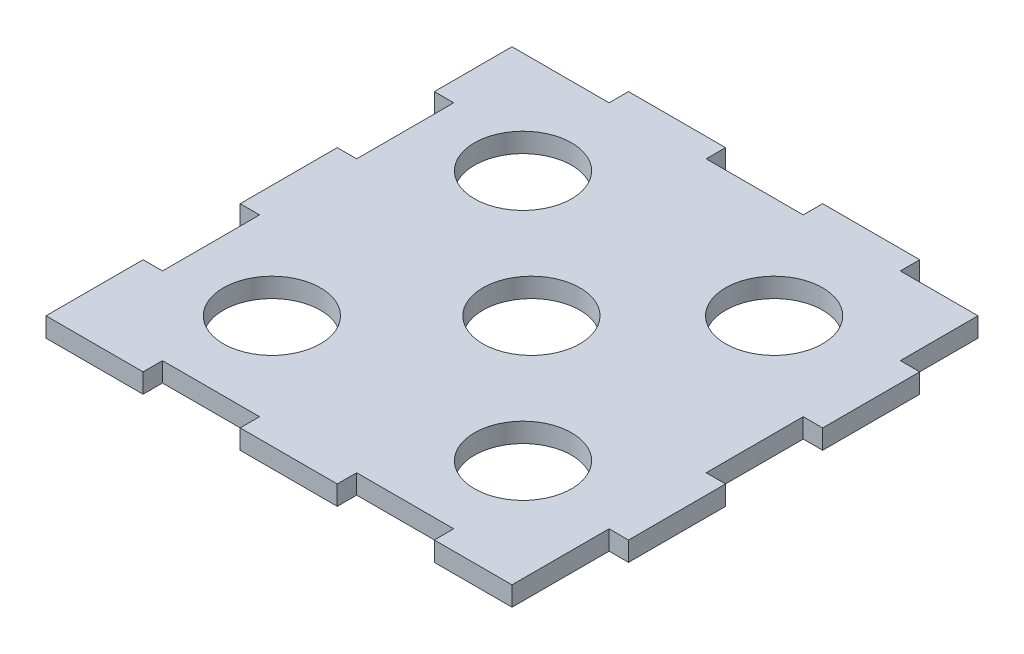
SolidWorks part; units mm, degrees
ref_plane "Front Plane" through (0, 0, 0) normal (0, 0, 1) x (1, 0, 0)
ref_plane "Top Plane" through (0, 0, 0) normal (0, 1, 0) x (1, 0, 0)
ref_plane "Right Plane" through (0, 0, 0) normal (1, 0, 0) x (0, 0, -1)
sketch "Sketch2" plane through (0, 0, 0) normal (0, 1, 0) x (1, 0, 0)
  line L1 (-50, 46) -> (-30, 46)
  line L2 (-50, 46) -> (-50, 30)
  line L3 (-50, -50) -> (-30, -50)
  line L4 (46, 46) -> (46, 30)
  line L8 (-30, 46) -> (-30, 50)
  line L9 (-30, 50) -> (-10, 50)
  line L11 (46, 30) -> (50, 30)
  line L14 (-10, 50) -> (-10, 46)
  line L15 (-10, 46) -> (10, 46)
  line L16 (10, 46) -> (10, 50)
  line L17 (10, 50) -> (30, 50)
  line L18 (30, 50) -> (30, 46)
  line L19 (30, 46) -> (46, 46)
  line L20 (-30, -50) -> (-30, -46)
  line L21 (-30, -46) -> (-10, -46)
  line L22 (-10, -46) -> (-10, -50)
  line L23 (-10, -50) -> (10, -50)
  line L24 (10, -50) -> (10, -46)
  line L25 (10, -46) -> (30, -46)
  line L26 (30, -46) -> (30, -50)
  line L27 (30, -50) -> (46, -50)
  line L29 (50, 30) -> (50, 10)
  line L30 (50, 10) -> (46, 10)
  line L31 (46, 10) -> (46, -10)
  line L32 (46, -10) -> (50, -10)
  line L33 (50, -10) -> (50, -30)
  line L34 (50, -30) -> (46, -30)
  line L35 (46, -30) -> (46, -50)
  line L36 (-50, 30) -> (-46, 30)
  line L37 (-46, 30) -> (-46, 10)
  line L38 (-46, 10) -> (-50, 10)
  line L39 (-50, 10) -> (-50, -10)
  line L40 (-50, -10) -> (-46, -10)
  line L41 (-46, -10) -> (-46, -30)
  line L42 (-46, -30) -> (-50, -30)
  line L43 (-50, -30) -> (-50, -50)
  circle A0 centre (0, 0) radius 10
  circle A1 centre (25, 25) radius 10
  circle A2 centre (25, -26.7321) radius 10
  circle A3 centre (-26.7321, -26.7321) radius 10
  circle A4 centre (-26.7321, 25) radius 10
  point P0 (0, 0)
extrude "Boss-Extrude1" add sketch "Sketch2" along normal blind 4
equation "\"Slit thick\"= 4"
equation "\"Slit wide\"= 20"
equation "\"Piece Thick\"= 4"
equation "\"Slit distance\"= 20"
equation "\"D3@Sketch2\"=\"Slit distance\""
equation "\"D4@Sketch2\"=\"Slit distance\""
equation "\"D6@Sketch2\"=\"Slit wide\""
equation "\"D8@Sketch2\"=\"Slit wide\""
equation "\"D10@Sketch2\"=\"Slit wide\""
equation "\"D12@Sketch2\"=\"Slit thick\""
equation "\"D14@Sketch2\"=\"Slit thick\""
equation "\"D15@Sketch2\"=\"Slit wide\""
equation "\"D16@Sketch2\"=\"Slit distance\""
equation "\"D18@Sketch2\"=\"Slit distance\""
equation "\"D20@Sketch2\"=\"Slit thick\""
equation "\"D21@Sketch2\"=\"Slit wide\""
equation "\"D22@Sketch2\"=\"Slit distance\""
equation "\"D23@Sketch2\"=\"Slit wide\""
equation "\"D24@Sketch2\"=\"Slit distance\""
equation "\"diam\"= 20"
equation "\"D25@Sketch2\"=\"diam\""
equation "\"D17@Sketch2\"=\"Slit wide\""
equation "\"D26@Sketch2\"=\"diam\""
equation "\"D27@Sketch2\"=\"diam\""
equation "\"D28@Sketch2\"=\"diam\""
equation "\"D29@Sketch2\"=\"diam\""
equation "\"D1@Boss-Extrude1\"=\"Piece Thick\""
